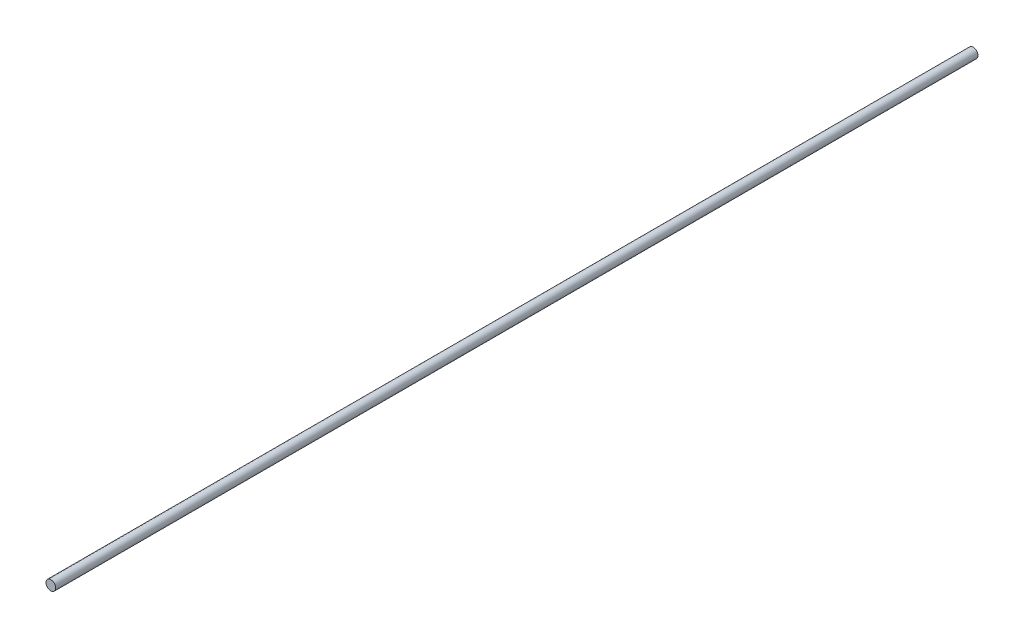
SolidWorks part; units mm, degrees
ref_plane "Front Plane" through (0, 0, 0) normal (0, 0, 1) x (1, 0, 0)
ref_plane "Top Plane" through (0, 0, 0) normal (0, 1, 0) x (1, 0, 0)
ref_plane "Right Plane" through (0, 0, 0) normal (1, 0, 0) x (0, 0, -1)
sketch "Sketch1" plane through (0, 0, 0) normal (0, 0, 1) x (1, 0, 0)
  circle A0 centre (0, 0) radius 30
  dimension "D1" = 60
extrude "Boss-Extrude1" add sketch "Sketch1" against normal blind 5700
